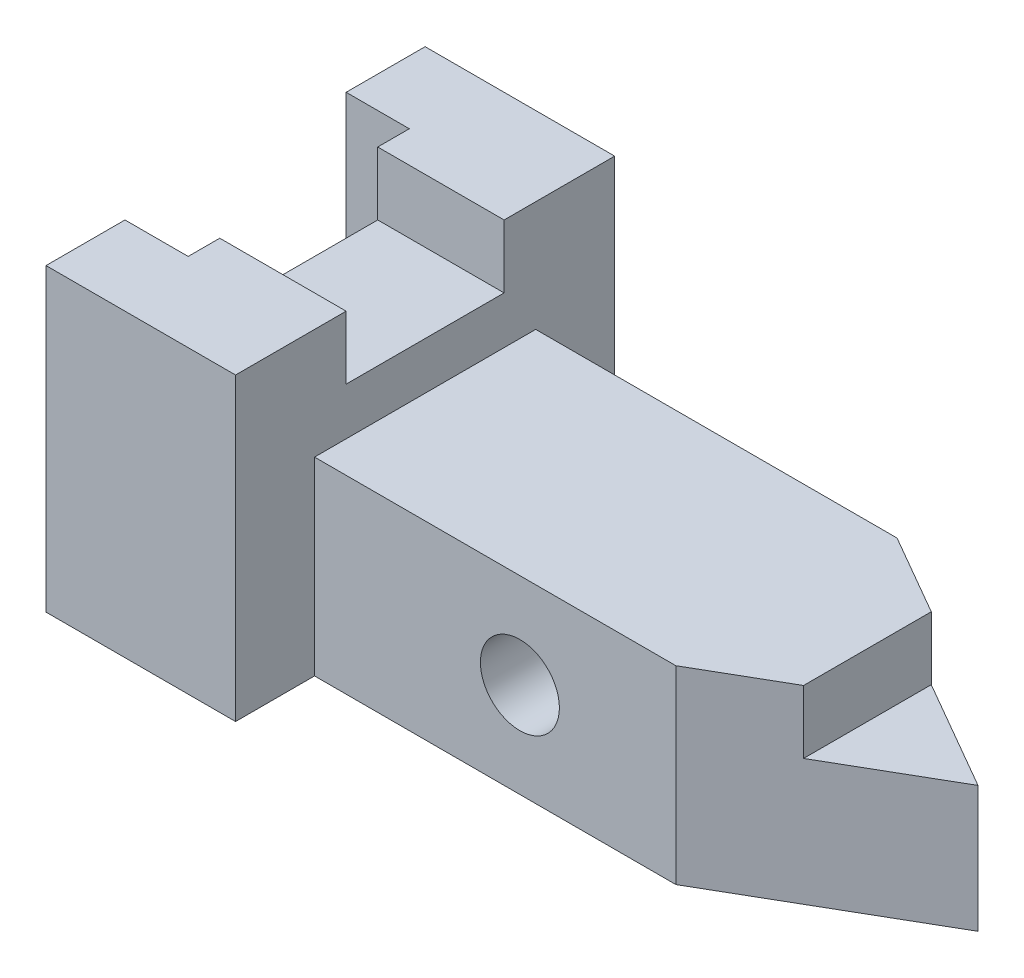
SolidWorks part; units mm, degrees
ref_plane "Plano frontal" through (0, 0, 0) normal (0, 0, 1) x (1, 0, 0)
ref_plane "Plano superior" through (0, 0, 0) normal (0, 1, 0) x (1, 0, 0)
ref_plane "Plano direito" through (0, 0, 0) normal (1, 0, 0) x (0, 0, -1)
sketch "Esboço1" plane through (0, 0, 0) normal (0, 0, 1) x (1, 0, 0)
  line L0 (0, 0) -> (24, 0)
  line L1 (0, 0) -> (0, -38)
  line L2 (0, -38) -> (24, -38)
  line L3 (24, 0) -> (24, -38)
  line L4 (24, -14) -> (94, -14)
  line L5 (94, -14) -> (94, -38)
  line L6 (24, -38) -> (94, -38)
  dimension "D1" = 24
  dimension "D2" = 38
  dimension "D3" = 94
  dimension "D4" = 24
extrude "Ressalto-extrusão1" add sketch "Esboço1" along normal blind 48 contours L3 L0 L1 L2 | L3 L6 L5 L4
sketch "Esboço5" plane through (0, 0, 0) normal (0, 1, 0) x (1, 0, 0)
  line L5 (0, -48) -> (0, 0) construction
  line L8 (0, -10) -> (8, -10)
  line L9 (0, -10) -> (0, -38)
  line L10 (0, -38) -> (8, -38)
  line L11 (8, -10) -> (8, -38)
extrude "Corte-extrusão4" cut sketch "Esboço5" against normal blind 55
sketch "Esboço6" plane through (0, 0, 0) normal (0, 1, 0) x (1, 0, 0)
  line L1 (8, -38) -> (8, -10) construction
  line L3 (24, -48) -> (24, 0) construction
  line L4 (8, -14) -> (24, -14)
  line L5 (8, -14) -> (8, -34)
  line L6 (8, -34) -> (24, -34)
  line L7 (24, -14) -> (24, -34)
extrude "Corte-extrusão5" cut sketch "Esboço6" against normal blind 8
sketch "Esboço7" plane through (0, -14, 0) normal (0, 1, 0) x (1, 0, 0)
  line L0 (24, 0) -> (24, -10)
  line L1 (24, -48) -> (24, 0) construction
  line L2 (24, -48) -> (24, -38)
  line L3 (94, -48) -> (94, 0) construction
  line L4 (24, -10) -> (94, -10)
  line L5 (24, -10) -> (24, -38)
  line L6 (24, -38) -> (94, -38)
  line L7 (94, -10) -> (94, -38)
extrude "Corte-extrusão6" cut sketch "Esboço7" against normal blind 34 contours L4 M8 M10 M7 | L6 M8 M9 M10
sketch "Esboço11" plane through (0, 0, 38) normal (0, 0, 1) x (1, 0, 0)
  line L0 (24, -38) -> (94, -38) construction
  circle A0 centre (50, -26) radius 5
  dimension "D3" = 10
  dimension "D1" = 12
extrude "Corte-extrusão8" cut sketch "Esboço11" against normal blind 34
sketch "Esboço12" plane through (0, 0, 38) normal (0, 0, 1) x (1, 0, 0)
  line L1 (94, -14) -> (80, -14)
  line L2 (94, -14) -> (94, -22)
  line L3 (94, -22) -> (80, -22)
  line L4 (80, -14) -> (80, -22)
  dimension "D1" = 14
  dimension "D2" = 8
extrude "Corte-extrusão9" cut sketch "Esboço12" against normal through all
chamfer "Chanfro1" distance 14 angle 60 2 edges at (94, -30, 38) (94, -30, 10)
